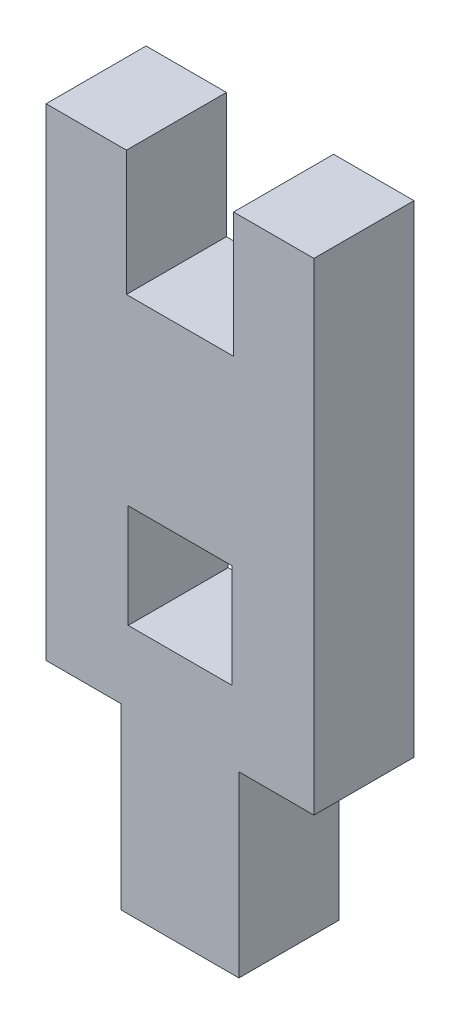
SolidWorks part; units mm, degrees
ref_plane "Front Plane" through (0, 0, 0) normal (0, 0, 1) x (1, 0, 0)
ref_plane "Top Plane" through (0, 0, 0) normal (0, 1, 0) x (1, 0, 0)
ref_plane "Right Plane" through (0, 0, 0) normal (1, 0, 0) x (0, 0, -1)
sketch "Sketch1" plane through (0, 0, 0) normal (0, 0, 1) x (1, 0, 0)
  line L1 (0, 0) -> (3.3, 0)
  line L2 (0, 0) -> (0, 5)
  line L4 (3.3, 0) -> (3.3, 5)
  line L28 (-2.1, 12.5) -> (-2.1, 18.5)
  line L29 (-2.1, 18.5) -> (0.15, 18.5)
  line L30 (0.15, 18.5) -> (0.15, 15)
  line L31 (0.15, 15) -> (3.15, 15)
  line L32 (3.15, 15) -> (3.15, 18.5)
  line L33 (3.15, 18.5) -> (5.4, 18.5)
  line L34 (5.4, 18.5) -> (5.4, 15.5)
  line L36 (1.65, 23.3023) -> (1.65, -4.475) construction
  line L37 (0, 5) -> (-2.1, 5)
  line L38 (-2.1, 5) -> (-2.1, 12.5)
  line L41 (5.4, 15.5) -> (5.4, 5)
  line L42 (5.4, 5) -> (3.3, 5)
  line L46 (0.2, 7) -> (3.1, 7)
  line L47 (0.2, 7) -> (0.2, 9.9)
  line L48 (0.2, 9.9) -> (3.1, 9.9)
  line L49 (3.1, 7) -> (3.1, 9.9)
  dimension "D1" = 7.5
  dimension "D2" = 3.3
  dimension "D3" = 2.9
  dimension "D4" = 5
  dimension "D6" = 18.5
  dimension "D7" = 3
  dimension "D8" = 2
  dimension "D9" = 2.25
  dimension "D10" = 2.25
  dimension "D11" = 3.5
  dimension "D12" = 2.9
extrude "Boss-Extrude1" add sketch "Sketch1" along normal blind 2.8
equation "\"mdf\" = 3mm - \"kerf\"'chess table material"
equation "\"diameter\"= ( 25mm - 5mm )'diameter of all of the pieces in relation with the chess table"
equation "\"size press fit\"= 5mm"
equation "\"gap\" = ( ( \"diameter\" - ( \"size press fit\" * 3 ) ) / 4mm ) + \"kerf\""
equation "\"gap press fit\" = ( \"diameter\" - \"size press fit\" - \"size press fit\" - \"gap\" - \"gap\" ) + \"kerf\""
equation "\"lenght\"= 18mm"
equation "\"D1@Boss-Extrude1\"=\"mdf\""
equation "\"gap y\"= \"gap\" + 1mm"
equation "\"kerf\"= 0.2"
